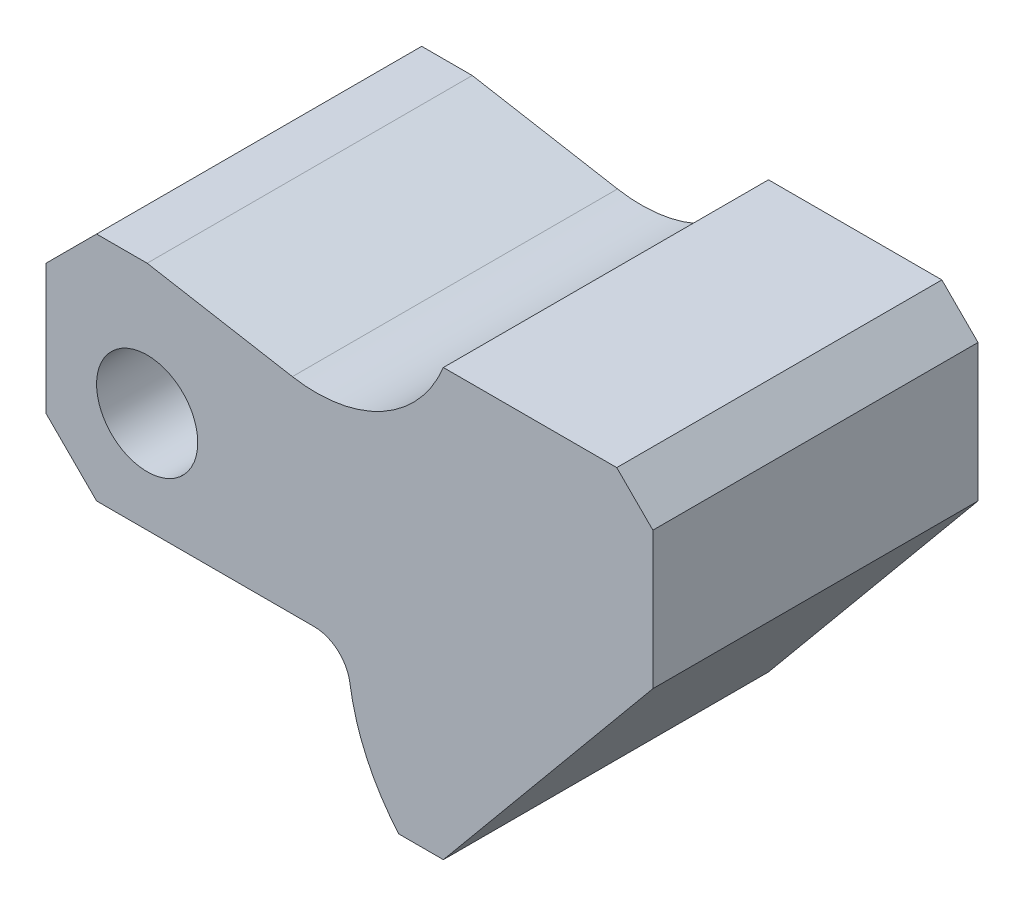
SolidWorks part; units mm, degrees
ref_plane "Front" through (0, 0, 0) normal (0, 0, 1) x (1, 0, 0)
ref_plane "Top" through (0, 0, 0) normal (0, 1, 0) x (1, 0, 0)
ref_plane "Right" through (0, 0, 0) normal (1, 0, 0) x (0, 0, -1)
sketch "Sketch1" plane through (0, 0, 0) normal (0, 0, 1) x (1, 0, 0)
  line L0 (0, 0) -> (0, 32)
  line L1 (0, 32) -> (14, 32)
  line L2 (14, 32) -> (34.104, 28.4551)
  line L3 (55, 40) -> (84, 40)
  line L4 (84, 40) -> (84, 16)
  line L5 (84, 16) -> (55, -19)
  line L6 (55, -19) -> (48.834, -19)
  line L7 (0, 0) -> (37.1125, 0)
  arc A0 (34.104, 28.4551) -> (55, 40) centre (37.4034, 47.1665) ccw
  arc A1 (37.1125, 0) -> (42.0582, -4.2647) centre (37.1125, -5) cw
  arc A2 (42.0582, -4.2647) -> (48.834, -19) centre (70.7429, 0) ccw
extrude "Boss-Extrude1" add sketch "Sketch1" along normal mid plane 45
chamfer "Chamfer1" distance 7 angle 45 2 edges at (0, 0, 0) (0, 32, 0)
chamfer "Chamfer2" distance 5 angle 45 1 edges at (84, 40, 0)
sketch "Sketch2" plane through (0, 0, 22.5) normal (0, 0, 1) x (1, 0, 0)
  line L0 (7, 0) -> (37.1125, 0) construction
  line L1 (0, 25) -> (0, 7) construction
  circle A0 centre (14, 14) radius 7
  dimension "D3" = 14
  dimension "D1" = 14
  dimension "D2" = 14
extrude "Cut-Extrude1" cut sketch "Sketch2" against normal through all
equation "\"A\"= 84"
equation "\"B\"= 59"
equation "\"C\"= 45"
equation "\"D3@Sketch1\"=\"A\""
equation "\"D8@Sketch1\"=\"B\""
equation "\"D1@Boss-Extrude1\"=\"C\""
